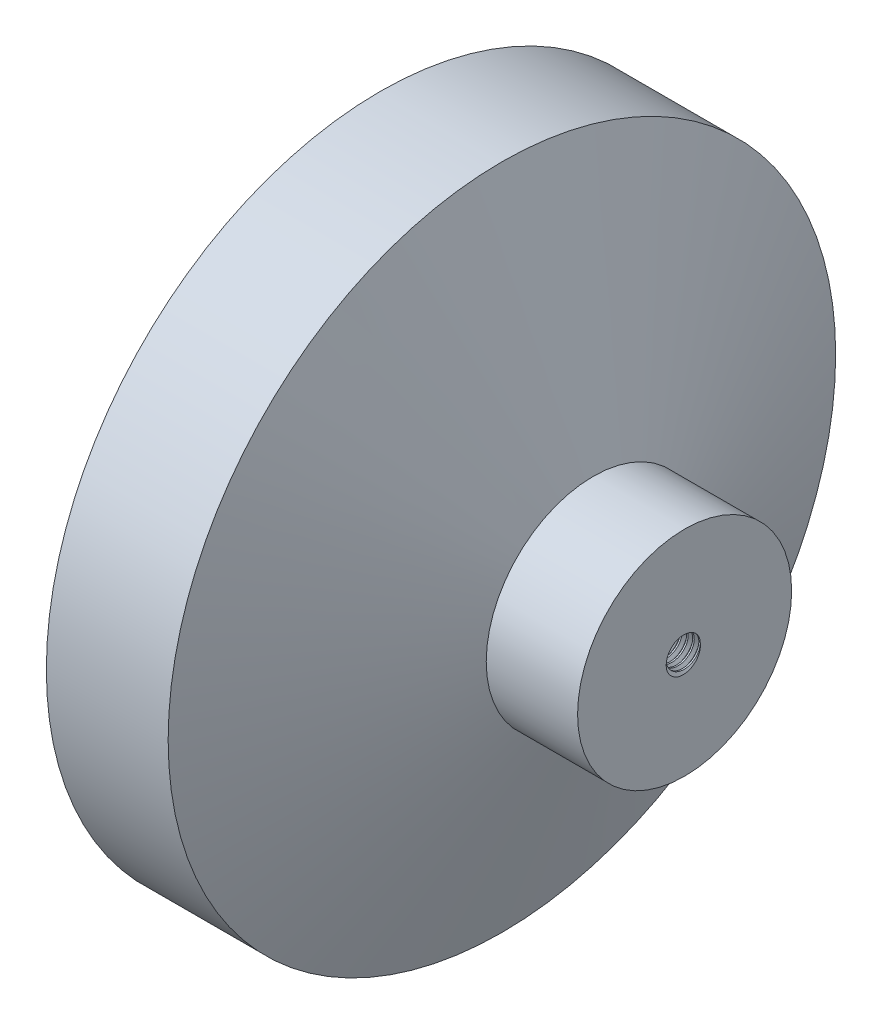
SolidWorks part; units mm, degrees
ref_plane "Plan de face" through (0, 0, 0) normal (0, 0, 1) x (1, 0, 0)
ref_plane "Plan de dessus" through (0, 0, 0) normal (0, 1, 0) x (1, 0, 0)
ref_plane "Plan de droite" through (0, 0, 0) normal (1, 0, 0) x (0, 0, -1)
sketch "Esquisse2" plane through (0, 0, 0) normal (0, 1, 0) x (1, 0, 0)
  line L0 (5.2763, 18.8342) -> (5.2763, 18.2642)
  line L1 (5.2763, 18.8342) -> (-9.7237, 18.8342)
  line L2 (-9.7237, 18.8342) -> (-9.7237, 3.8342)
  line L3 (-19.1297, 21.4092) -> (30.8703, 21.4092) construction
  line L4 (-24.7237, -33.3908) -> (-44.7237, -33.3908)
  line L5 (-9.7237, 3.8342) -> (5.2763, 3.8342)
  line L13 (-9.7237, 3.8342) -> (-9.7237, 18.8342)
  line L14 (-9.7237, 18.8342) -> (5.2763, 18.8342)
  line L15 (5.2763, 3.8342) -> (5.2763, 18.8342)
  line L16 (-9.7237, 18.8342) -> (5.2763, 18.8342)
  line L17 (-44.7237, -33.3908) -> (-24.7237, -33.3908)
  line L18 (-9.7237, 3.8342) -> (-9.7237, 18.8342)
  line L19 (-9.7237, 3.8342) -> (-24.7237, -33.3908)
  line L20 (-9.7237, 18.8342) -> (-24.7237, -18.3908)
  line L21 (-24.7237, -33.3908) -> (-24.7237, -18.3908)
  line L22 (-44.7237, -33.3908) -> (-44.7237, -18.3908)
  line L23 (-44.7237, -18.3908) -> (-24.7237, -18.3908)
  line L24 (-24.7237, -33.3908) -> (-24.7237, -18.3908)
  line L25 (-9.7237, 18.8342) -> (-9.7237, 21.4092)
  line L26 (-9.7237, 21.4092) -> (5.2763, 21.4092)
  line L27 (5.2763, 18.8342) -> (5.2763, 21.4092)
revolve "Révolution4" add sketch "Esquisse2" angle 360 about L3
hole_wizard "Dégagement #02" positions "Esquisse12" profile "Esquisse13" hole size "#0" standard "Ansi Inch"
sketch "Esquisse12" plane through (5.2763, 0, 0) normal (1, 0, 0) x (0, 0, -1)
  line L0 (18.8342, 0) -> (21.4092, 0) construction
  line L1 (18.8342, 0) -> (21.4092, 0) construction
  point P0 (21.4092, 0)
sketch "Esquisse13" plane through (5.2763, 0, -21.4092) normal (0, 1, 0) x (0, 0, -1)
  line L0 (0, 0) -> (0, 15)
  line L1 (0, 15) -> (2.5781, 15)
  line L2 (2.5781, 15) -> (2.5781, 0)
  line L5 (2.5781, 0) -> (0, 0)
  line L11 (0, -6.35) -> (0, 107.95) construction
  dimension "Diamètre du perçage jusqu'au prochain" = 5.1562
  dimension "Profondeur du perçage jusqu'au prochain" = 15
thread "Filetage3" pitch 1 start angle 0, offset 0, length 15, pitch 1, diameter 5.1562
ref_plane "Plan3" through (-9.7237, 0, -23.9873) normal (0, -1, 0) x (0, 0, -1)
sketch "Profil de filetage3" plane through (-9.7237, 0, -23.9873) normal (0, -1, 0) x (0, 0, -1)
  line L0 (0, 0) -> (0, 1) construction
  line L1 (0, 0) -> (0.5413, 0.3125)
  line L2 (0.5413, 0.3125) -> (0.5413, 0.4375)
  line L3 (0.5413, 0.4375) -> (0, 0.75)
  line L4 (0.5413, 0.375) -> (0, 0.375) construction
  line L11 (0, 0) -> (0, 0.75)
  point P2 (0, 0)
  dimension "Pitch" = 1
  dimension "Profile_Angle" = 60
  dimension "Profile_Land" = 0.125
  dimension "Profile_Height" = 0.5413
